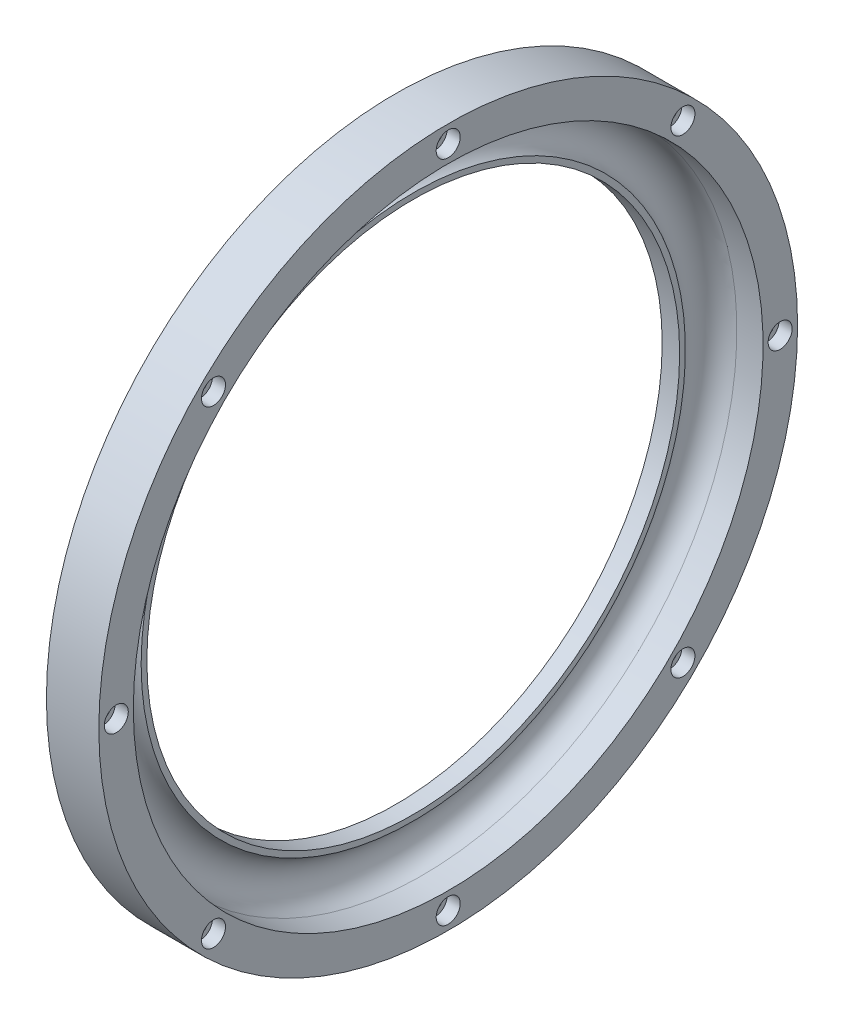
SolidWorks part; units mm, degrees
ref_plane "Plane1" through (0, 0, 0) normal (0, 0, 1) x (1, 0, 0)
ref_plane "Plane2" through (0, 0, 0) normal (0, 1, 0) x (1, 0, 0)
ref_plane "Plane3" through (0, 0, 0) normal (1, 0, 0) x (0, 0, -1)
sketch "Esquisse3" plane through (0, 0, 0) normal (0, 0, 1) x (1, 0, 0)
  line L0 (0, -12.3895) -> (0, 140.6228) construction
  line L1 (-7.6644, 0) -> (165.3613, 0) construction
  line L2 (82.7634, 61) -> (-7.6644, 61) construction
  line L3 (-7.6644, 61.9) -> (65.197, 61.9) construction
  line L4 (-7.6644, 67) -> (93.8579, 67) construction
  line L5 (-7.6644, 80) -> (107.7261, 80) construction
  line L6 (-7.6644, 20) -> (63.5791, 20) construction
  line L7 (12, -12.3895) -> (12, 140.6228) construction
  line L8 (-7.6644, 72.1) -> (65.197, 72.1) construction
  line L9 (6, 105.0097) -> (6, 53.0928) construction
  line L10 (4, 53.0928) -> (4, 64.2295) construction
  line L12 (-2.5, 99.8222) -> (-2.5, 77.136) construction
  line L13 (6, 72.1) -> (12, 72.1)
  line L14 (4, 61) -> (0, 61)
  line L15 (0, 61) -> (0, 80)
  line L16 (0, 80) -> (12, 80)
  line L17 (12, 80) -> (12, 72.1)
  line L19 (4, 62.3085) -> (4, 61)
  circle A0 centre (6, 67) radius 5 construction
  arc A1 (6, 72.1) -> (4, 62.3085) centre (6, 67) ccw
  dimension "D7" = 5.1
  dimension "D1" = 20
  dimension "D3" = 61
  dimension "D4" = 67
  dimension "D8" = 6
  dimension "D9" = 4
  dimension "D2" = 80
  dimension "D5" = 12
  dimension "D6" = 5.1
  dimension "D11" = 2.5
revolve "Révolution1" add sketch "Esquisse3" angle 360 about L1
sketch "Esquisse4" plane through (12, 0, 0) normal (1, 0, 0) x (0, 0, -1)
  line L0 (0, -5.5032) -> (0, 98.4281) construction
  circle A0 centre (0, 0) radius 76 construction
  circle A1 centre (0, 76) radius 1.6
  circle A2 centre (53.7401, 53.7401) radius 1.6
  circle A3 centre (76, 0) radius 1.6
  circle A4 centre (53.7401, -53.7401) radius 1.6
  circle A5 centre (0, -76) radius 1.6
  circle A6 centre (-53.7401, -53.7401) radius 1.6
  circle A7 centre (-76, 0) radius 1.6
  circle A8 centre (-53.7401, 53.7401) radius 1.6
extrude "Enlèv. mat.-Extru.1" cut sketch "Esquisse4" against normal blind 12
sketch "Esquisse5" plane through (12, 0, 0) normal (1, 0, 0) x (0, 0, -1)
  circle A0 centre (0, 76) radius 2.75
  circle A1 centre (53.7401, 53.7401) radius 2.75
  circle A2 centre (76, 0) radius 2.75
  circle A3 centre (53.7401, -53.7401) radius 2.75
  circle A4 centre (0, -76) radius 2.75
  circle A5 centre (-53.7401, -53.7401) radius 2.75
  circle A6 centre (-76, 0) radius 2.75
  circle A7 centre (-53.7401, 53.7401) radius 2.75
extrude "Enlèv. mat.-Extru.2" cut sketch "Esquisse5" against normal blind 3
ref_plane "Plan1" through (6, 0, 0) normal (1, 0, 0) x (0, 0, -1)
sketch "Esquisse6" plane through (6, 0, 0) normal (1, 0, 0) x (0, 0, -1)
  circle A0 centre (0, 0) radius 67 construction
